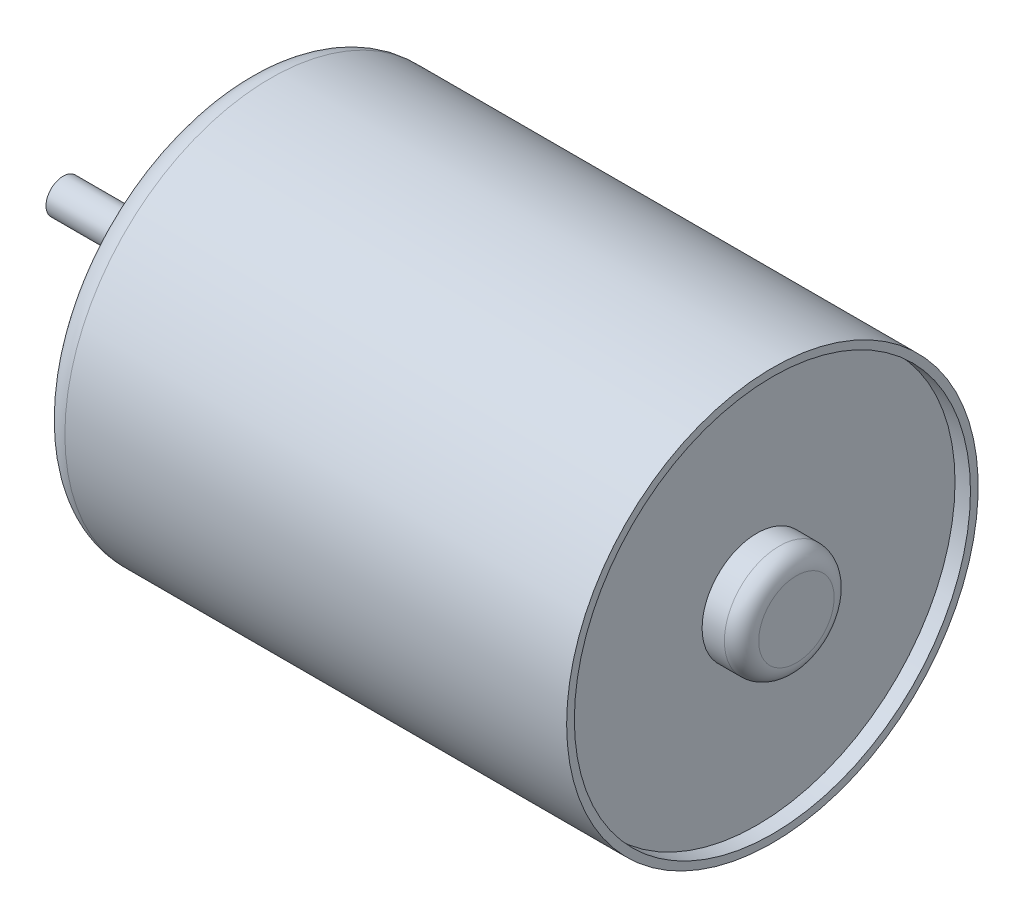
SolidWorks part; units mm, degrees
ref_plane "Plan de face" through (0, 0, 0) normal (0, 0, 1) x (1, 0, 0)
ref_plane "Plan de dessus" through (0, 0, 0) normal (0, 1, 0) x (1, 0, 0)
ref_plane "Plan de droite" through (0, 0, 0) normal (1, 0, 0) x (0, 0, -1)
sketch "Esquisse1" plane through (0, 0, 0) normal (0, 0, 1) x (1, 0, 0)
  line L0 (-41.5362, 27.1669) -> (-41.5362, 28.1669)
  line L1 (-41.5362, 28.1669) -> (-32.0362, 28.1669)
  line L2 (-32.0362, 28.1669) -> (-32.0362, 29.7669)
  line L3 (-32.0362, 29.7669) -> (-32.5362, 29.7669)
  line L4 (-32.5362, 29.7669) -> (-32.5362, 30.3669)
  line L5 (-32.5362, 30.3669) -> (-30.9362, 30.3669)
  line L6 (-30.9362, 30.3669) -> (-30.9362, 39.1669)
  line L7 (-30.9362, 39.1669) -> (-0.1762, 39.1669)
  line L8 (-0.1762, 39.1669) -> (-0.1762, 38.7169)
  line L9 (-0.1762, 38.7169) -> (-1.0762, 38.7169)
  line L10 (-41.5362, 27.1669) -> (-1.0762, 27.1669)
  line L11 (-1.0762, 27.1669) -> (-1.0762, 38.7169)
  dimension "D1" = 1
  dimension "D2" = 9.5
  dimension "D3" = 1.6
  dimension "D4" = 0.5
  dimension "D5" = 3.2
  dimension "D6" = 1.6
  dimension "D7" = 12
  dimension "D8" = 30.76
  dimension "D9" = 0.45
  dimension "D10" = 0.9
revolve "Révolution1" add sketch "Esquisse1" angle 360 about L10
fillet "Congé1" radius 1.5 1 edges at (-30.9362, 27.1669, 12)
sketch "Esquisse2" plane through (-1.0762, 0, 0) normal (1, 0, 0) x (0, 0, -1)
  circle A0 centre (0, 27.1669) radius 3.2
extrude "Boss.-Extru.1" add sketch "Esquisse2" along normal blind 2.3
fillet "Congé2" radius 1 1 edges at (1.2238, 27.1669, -3.2)
